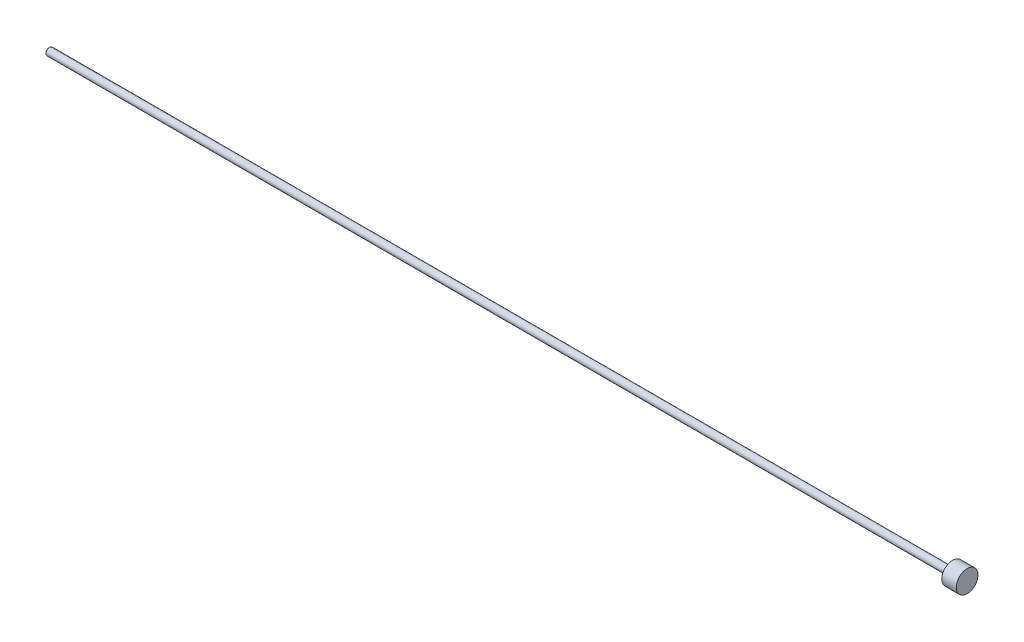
SolidWorks part; units mm, degrees
ref_plane "Front" through (0, 0, 0) normal (0, 0, 1) x (1, 0, 0)
ref_plane "Top" through (0, 0, 0) normal (0, 1, 0) x (1, 0, 0)
ref_plane "Right" through (0, 0, 0) normal (1, 0, 0) x (0, 0, -1)
sketch "Sketch2" plane through (1130.0854, 0, 0) normal (-1, 0, 0) x (0, 0, 1)
  circle A0 centre (0, 0) radius 3.175
  dimension "D1" = 6.35
extrude "Main_body" add sketch "Sketch2" along normal up to surface (803.2115 mm away)
sketch "Sketch3" plane through (1130.0854, 0, 0) normal (-1, 0, 0) x (0, 0, 1)
  circle A0 centre (0, 0) radius 9.525
  circle A1 centre (0, 0) radius 9.525 construction
extrude "Piston Simulation" add sketch "Sketch3" along normal blind 12.7
chamfer "Chamfer1" distance 0.508 angle 45 1 edges at (326.8739, 0, 3.175)
